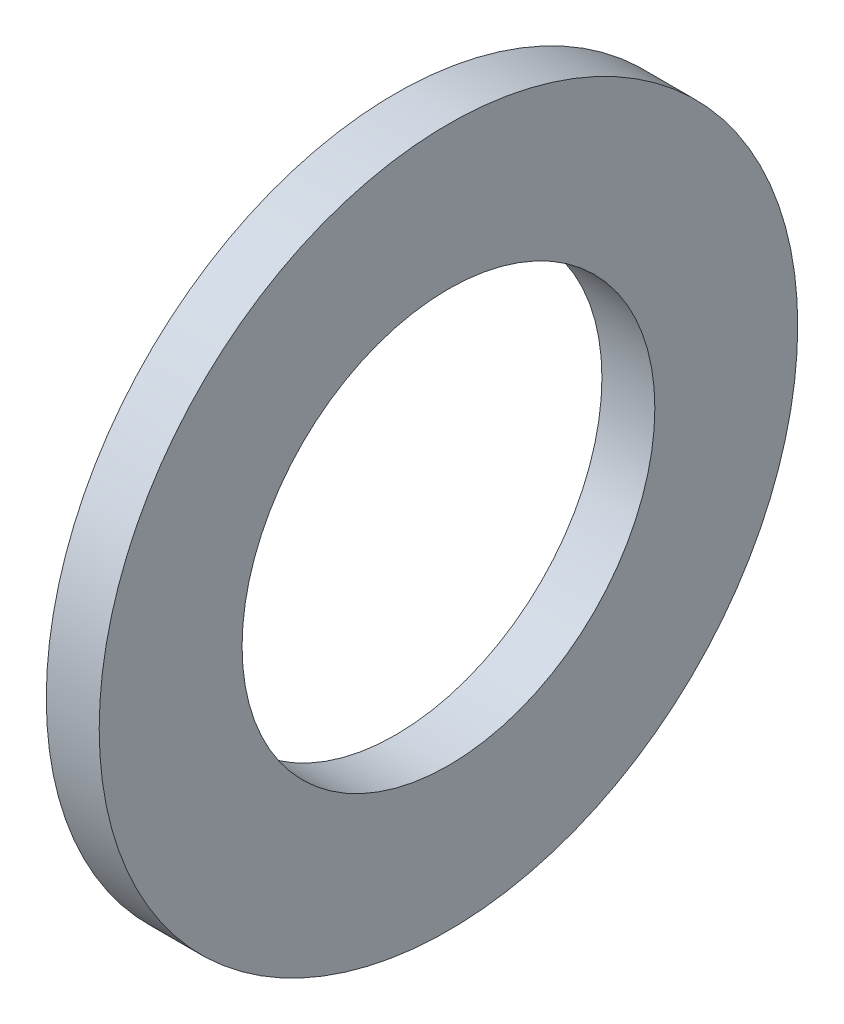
SolidWorks part; units mm, degrees
ref_plane "Plane1" through (0, 0, 0) normal (0, 0, 1) x (1, 0, 0)
ref_plane "Plane2" through (0, 0, 0) normal (0, 1, 0) x (1, 0, 0)
ref_plane "Plane3" through (0, 0, 0) normal (1, 0, 0) x (0, 0, -1)
other "Configuration Table"
sketch "Sketch1" plane through (0, 0, 0) normal (0, 0, 1) x (1, 0, 0)
  line L0 (-34.925, 0) -> (9.525, 0) construction
  line L1 (0, 19.5) -> (0, 33)
  line L2 (0, 33) -> (-5, 33)
  line L3 (-5, 33) -> (-5, 19.5)
  line L4 (-5, 19.5) -> (0, 19.5)
  dimension "Thickness" = 5
  dimension "Inside_dia" = 39
  dimension "Outside_dia" = 66
revolve "Base-Revolve" add sketch "Sketch1" angle 360 about L0
